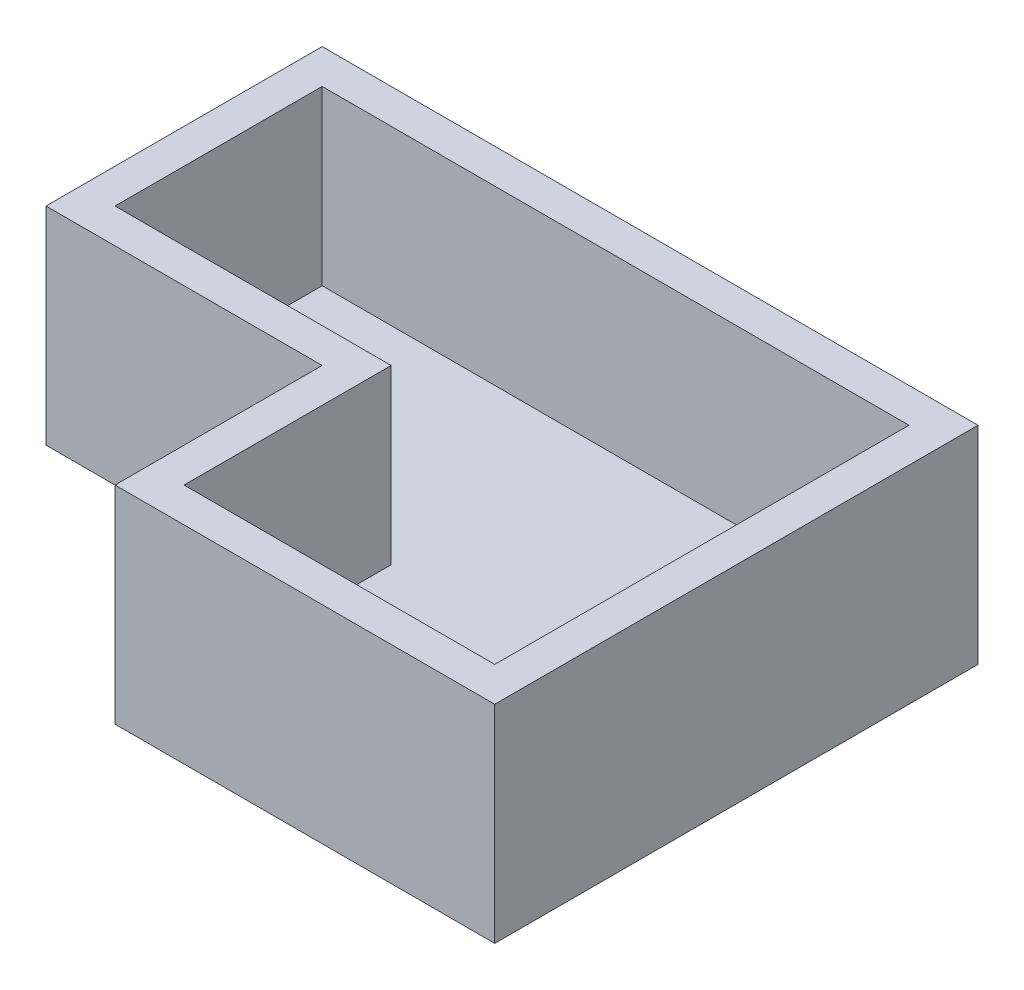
SolidWorks part; units mm, degrees
ref_plane "Alzado" through (0, 0, 0) normal (0, 0, 1) x (1, 0, 0)
ref_plane "Planta" through (0, 0, 0) normal (0, 1, 0) x (1, 0, 0)
ref_plane "Vista lateral" through (0, 0, 0) normal (1, 0, 0) x (0, 0, -1)
sketch "Croquis1" plane through (0, 0, 0) normal (0, 1, 0) x (1, 0, 0)
  line L0 (-69.5708, 63.0901) -> (100.4292, 63.0901)
  line L1 (100.4292, 63.0901) -> (100.4292, -56.9099)
  line L2 (100.4292, -56.9099) -> (10.4292, -56.9099)
  line L3 (10.4292, -56.9099) -> (10.4292, 3.0901)
  line L4 (10.4292, 3.0901) -> (-69.5708, 3.0901)
  line L5 (-69.5708, 3.0901) -> (-69.5708, 63.0901)
  dimension "D1" = 120
  dimension "D2" = 170
  dimension "D3" = 90
  dimension "D4" = 60
extrude "Extruir-Lámina1" add sketch "Croquis1" along normal blind 60 thin
sketch "Croquis2" plane through (0, 0, 0) normal (0, 1, 0) x (1, 0, 0)
  line L0 (-69.5708, 3.0901) -> (10.4292, 3.0901)
  line L1 (10.4292, 3.0901) -> (10.4292, -56.9099)
  line L2 (10.4292, -56.9099) -> (100.4292, -56.9099)
  line L3 (100.4292, -56.9099) -> (100.4292, 63.0901)
  line L4 (100.4292, 63.0901) -> (-69.5708, 63.0901)
  line L5 (-69.5708, 3.0901) -> (-69.5708, 63.0901)
extrude "Saliente-Extruir1" add sketch "Croquis2" along normal blind 10
